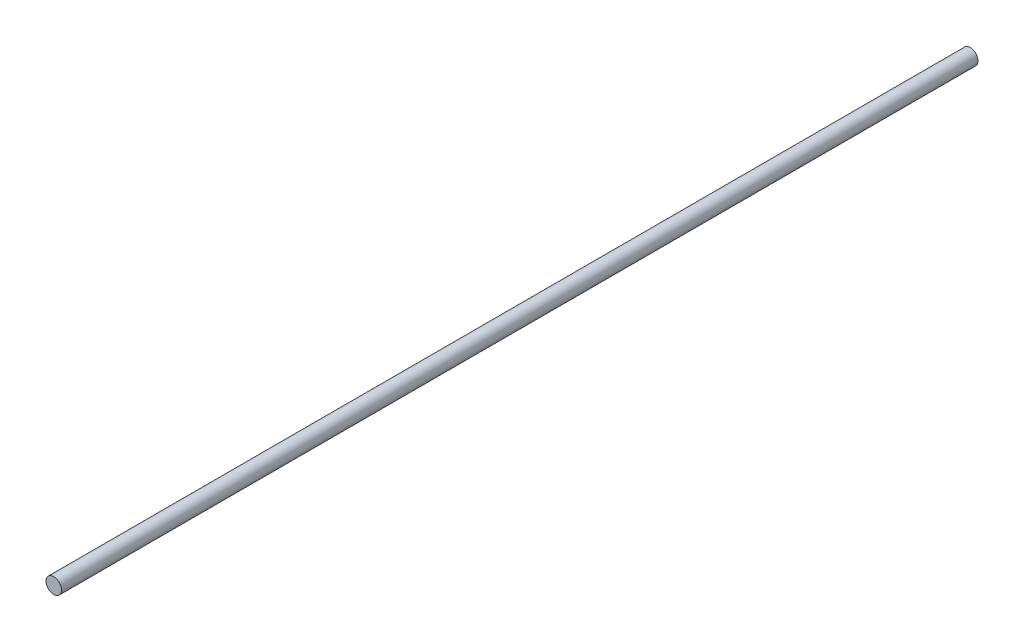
SolidWorks part; units mm, degrees
ref_plane "Front Plane" through (0, 0, 0) normal (0, 0, 1) x (1, 0, 0)
ref_plane "Top Plane" through (0, 0, 0) normal (0, 1, 0) x (1, 0, 0)
ref_plane "Right Plane" through (0, 0, 0) normal (1, 0, 0) x (0, 0, -1)
sketch "Sketch1" plane through (0, 0, 0) normal (0, 0, 1) x (1, 0, 0)
  circle A0 centre (0, 0) radius 30
  dimension "D1" = 60
extrude "Boss-Extrude1" add sketch "Sketch1" against normal blind 3550
